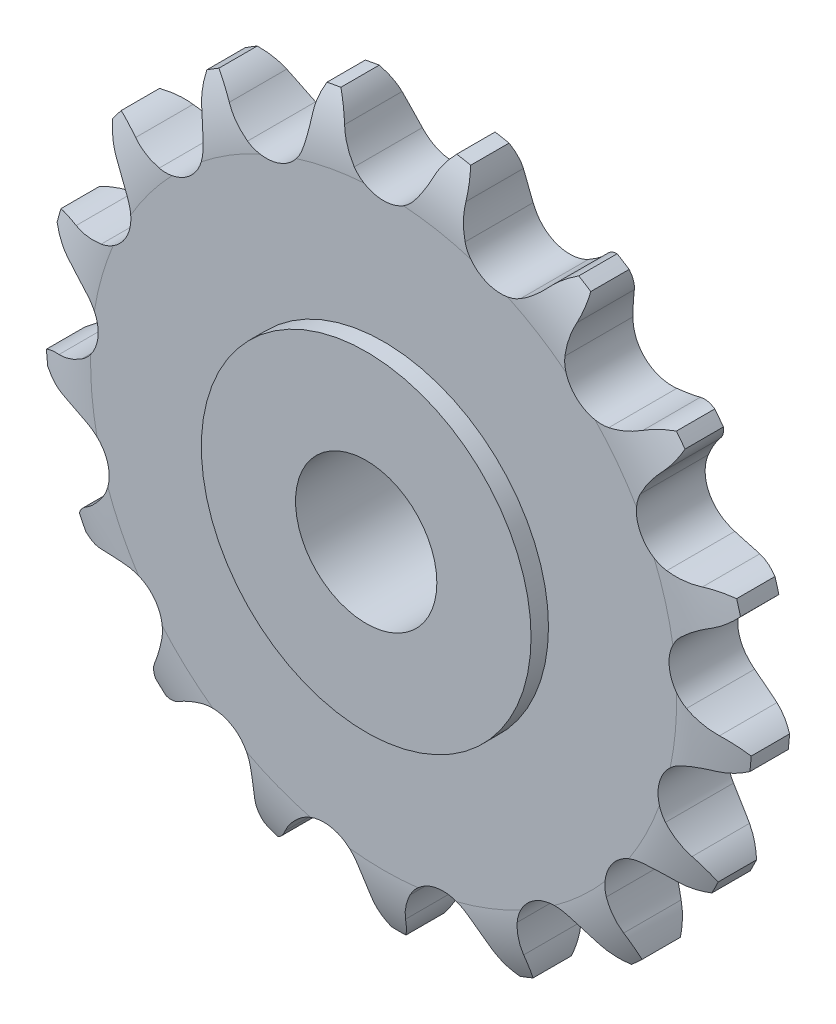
SolidWorks part; units mm, degrees
ref_plane "Front" through (0, 0, 0) normal (0, 0, 1) x (1, 0, 0)
ref_plane "Top" through (0, 0, 0) normal (0, 1, 0) x (1, 0, 0)
ref_plane "Right" through (0, 0, 0) normal (1, 0, 0) x (0, 0, -1)
sketch "ｽｹｯﾁ1" plane through (0, 0, 0) normal (1, 0, 0) x (0, 0, -1)
  line L0 (0, -42.5) -> (0, 0) construction
  line L1 (5.5, 17.5) -> (5.5, 7.5)
  line L3 (-5.5, 7.5) -> (-5.5, 17.5)
  line L4 (-3.65, 31.1) -> (-3.65, 17.5)
  line L8 (3.65, 17.5) -> (3.65, 31.1)
  line L10 (-10.5, 0) -> (10.5, 0) construction
  line L12 (-5.5, 7.5) -> (5.5, 7.5)
  line L14 (-5.5, 17.5) -> (-3.65, 17.5)
  line L15 (3.65, 17.5) -> (5.5, 17.5)
  line L17 (2.0365, 37.5) -> (-2.0365, 37.5)
  arc A4 (-2.0365, 37.5) -> (-3.65, 31.1) centre (9.85, 31.1) ccw
  arc A5 (3.65, 31.1) -> (2.0365, 37.5) centre (-9.85, 31.1) ccw
revolve "回転1" add sketch "ｽｹｯﾁ1" angle 360 about L10
sketch "ｽｹｯﾁ2" plane through (0, 0, 0) normal (0, 0, 1) x (1, 0, 0)
  arc A2 (-29.877, -11.7768) -> (-31.6016, -5.7154) centre (-33.1526, -9.4327) ccw
  arc A3 (31.6016, -5.7154) -> (29.877, -11.7768) centre (33.1526, -9.4327) ccw
  arc A4 (19.5034, -25.5136) -> (14.1454, -28.8311) centre (18.1453, -29.3056) ccw
  arc A5 (-12.8403, -35.2332) -> (-11.0486, -33.2967) centre (-16.6989, -29.8659) ccw
  arc A6 (-8.9698, -30.8362) -> (-11.0486, -33.2967) centre (-2.1761, -38.684) ccw
  arc A7 (-14.2669, -32.05) -> (-14.1454, -28.8312) centre (-24.4531, -30.0539) ccw
  arc A8 (-14.2669, -32.05) -> (-14.2474, -34.6881) centre (-7.7799, -33.3211) ccw
  arc A9 (-24.7009, -28.2155) -> (-14.2474, -34.6881) centre (0, 0) ccw
  arc A10 (-23.6052, -21.7743) -> (-27.403, -16.7453) centre (-27.5064, -20.7719) ccw
  arc A11 (-32.1353, -14.0737) -> (-33.8981, -16.0364) centre (-28.1977, -19.3833) ccw
  arc A12 (-37.2629, -4.2107) -> (-33.8981, -16.0364) centre (0, 0) ccw
  arc A13 (-27.403, -16.7453) -> (-30.5969, -17.1632) centre (-27.6694, -27.1218) ccw
  arc A14 (-33.2255, -17.3872) -> (-30.5969, -17.1632) centre (-32.4612, -10.8212) ccw
  arc A15 (-32.1353, -14.0737) -> (-29.877, -11.7768) centre (-38.3182, -5.7361) ccw
  arc A16 (-14.1454, -28.8312) -> (-19.5034, -25.5136) centre (-18.1453, -29.3056) ccw
  arc A17 (-24.8813, -24.7319) -> (-25.8161, -27.1989) centre (-19.2915, -28.2606) ccw
  arc A18 (-24.7009, -28.2155) -> (-22.3306, -27.0571) centre (-26.3601, -21.8168) ccw
  arc A19 (-19.5034, -25.5136) -> (-22.3306, -27.0571) centre (-16.0034, -35.2857) ccw
  arc A20 (-33.2255, -17.3872) -> (-25.8161, -27.1989) centre (0, 0) ccw
  arc A21 (-24.8813, -24.7319) -> (-23.6052, -21.7743) centre (-33.6585, -19.1909) ccw
  arc A22 (14.1454, -28.8311) -> (14.2669, -32.05) centre (24.4531, -30.0539) ccw
  arc A23 (-2.7752, -31.9942) -> (-8.9698, -30.8362) centre (-6.3336, -33.8815) ccw
  arc A24 (8.9698, -30.8362) -> (2.7752, -31.9942) centre (6.3336, -33.8815) ccw
  arc A25 (-1.7257, -35.0395) -> (-0.7545, -37.4924) centre (4.7824, -33.8815) ccw
  arc A26 (0.7545, -37.4924) -> (1.7257, -35.0395) centre (-4.7824, -33.8815) ccw
  arc A27 (-12.8403, -35.2332) -> (-0.7545, -37.4924) centre (0, 0) ccw
  arc A28 (-1.7257, -35.0395) -> (-2.7752, -31.9942) centre (-11.9451, -36.8579) ccw
  arc A29 (2.7752, -31.9942) -> (1.7257, -35.0395) centre (11.9451, -36.8579) ccw
  arc A30 (11.0486, -33.2967) -> (12.8403, -35.2332) centre (16.6989, -29.8659) ccw
  arc A31 (11.0486, -33.2967) -> (8.9698, -30.8362) centre (2.1761, -38.684) ccw
  arc A32 (0.7545, -37.4924) -> (12.8403, -35.2332) centre (0, 0) ccw
  arc A33 (14.2474, -34.6881) -> (14.2669, -32.05) centre (7.7799, -33.3211) ccw
  arc A34 (27.403, -16.7453) -> (23.6052, -21.7743) centre (27.5064, -20.7719) ccw
  arc A35 (25.8161, -27.1989) -> (24.8813, -24.7319) centre (19.2915, -28.2606) ccw
  arc A36 (22.3306, -27.0571) -> (24.7009, -28.2155) centre (26.3601, -21.8168) ccw
  arc A37 (22.3306, -27.0571) -> (19.5034, -25.5136) centre (16.0034, -35.2857) ccw
  arc A38 (14.2474, -34.6881) -> (24.7009, -28.2155) centre (0, 0) ccw
  arc A39 (23.6052, -21.7743) -> (24.8813, -24.7319) centre (33.6585, -19.1909) ccw
  arc A40 (33.8981, -16.0364) -> (32.1353, -14.0737) centre (28.1977, -19.3833) ccw
  arc A41 (30.5969, -17.1632) -> (27.403, -16.7453) centre (27.6694, -27.1218) ccw
  arc A42 (25.8161, -27.1989) -> (33.2255, -17.3872) centre (0, 0) ccw
  arc A43 (30.5969, -17.1632) -> (33.2255, -17.3872) centre (32.4612, -10.8212) ccw
  arc A44 (29.877, -11.7768) -> (32.1353, -14.0737) centre (38.3182, -5.7361) ccw
  arc A45 (19.0957, 32.2739) -> (16.9787, 30.6996) centre (21.9024, 26.289) ccw
  arc A46 (19.2023, 25.741) -> (23.8595, 21.4954) centre (23.2212, 25.4725) ccw
  arc A47 (-8.6069, 30.9395) -> (-8.1348, 34.1258) centre (-18.5143, 34.0354) ccw
  arc A48 (8.1348, 34.1258) -> (8.6069, 30.9395) centre (18.5143, 34.0354) ccw
  arc A49 (3.151, 31.9593) -> (4.7422, 34.76) centre (-4.9691, 38.4252) ccw
  arc A50 (-4.7422, 34.76) -> (-3.151, 31.9593) centre (4.9691, 38.4252) ccw
  arc A51 (-14.4832, 28.6629) -> (-8.6069, 30.9395) centre (-12.4514, 32.1408) ccw
  arc A52 (-30.0133, 11.4249) -> (-27.2043, 17.0661) centre (-30.8548, 15.3639) ccw
  arc A53 (-32.1137, -0.1887) -> (-31.5323, 6.0864) centre (-34.3214, 3.1803) ccw
  arc A54 (-35.0492, -1.5147) -> (-32.1137, -0.1887) centre (-37.8028, 8.4933) ccw
  arc A55 (-31.6016, -5.7154) -> (-34.7308, -4.9514) centre (-35.5985, -15.295) ccw
  arc A56 (-36.2676, 9.5346) -> (-37.4021, -2.7081) centre (0, 0) ccw
  arc A57 (-37.2629, -4.2107) -> (-34.7308, -4.9514) centre (-34.1782, 1.6358) ccw
  arc A58 (-35.0492, -1.5147) -> (-37.4021, -2.7081) centre (-33.2957, -7.8882) ccw
  arc A59 (-33.2296, 11.2488) -> (-35.8547, 10.986) centre (-33.8968, 4.6722) ccw
  arc A60 (-31.5323, 6.0864) -> (-34.1741, 7.9292) centre (-38.7198, -1.4025) ccw
  arc A61 (-30.3743, 21.9921) -> (-35.8547, 10.986) centre (0, 0) ccw
  arc A62 (-36.2676, 9.5346) -> (-34.1741, 7.9292) centre (-31.2793, 13.872) ccw
  arc A63 (-33.2296, 11.2488) -> (-30.0133, 11.4249) centre (-32.1819, 21.5757) ccw
  arc A64 (-26.9221, 22.4931) -> (-23.8595, 21.4954) centre (-22.2147, 31.7442) ccw
  arc A65 (-26.9221, 22.4931) -> (-29.4649, 23.1963) centre (-29.92, 16.6017) ccw
  arc A66 (-20.3787, 31.4795) -> (-29.4649, 23.1963) centre (0, 0) ccw
  arc A67 (-27.2043, 17.0661) -> (-29.0021, 19.7389) centre (-36.6117, 12.6794) ccw
  arc A68 (-30.3743, 21.9921) -> (-29.0021, 19.7389) centre (-24.1559, 24.2346) ccw
  arc A69 (-23.8595, 21.4954) -> (-19.2023, 25.741) centre (-23.2212, 25.4725) ccw
  arc A70 (-16.9787, 30.6996) -> (-19.0957, 32.2739) centre (-21.9024, 26.289) ccw
  arc A71 (-19.2023, 25.741) -> (-19.9131, 28.8827) centre (-29.5591, 25.0489) ccw
  arc A72 (-7.6309, 36.7154) -> (-19.0957, 32.2739) centre (0, 0) ccw
  arc A73 (-20.3787, 31.4795) -> (-19.9131, 28.8827) centre (-13.7702, 31.3242) ccw
  arc A74 (-16.9787, 30.6996) -> (-14.4832, 28.6629) centre (-9.2472, 37.6255) ccw
  arc A76 (-3.151, 31.9593) -> (3.151, 31.9593) centre (0, 34.4684) ccw
  arc A77 (8.6069, 30.9395) -> (14.4832, 28.6629) centre (12.4514, 32.1408) ccw
  arc A78 (14.4832, 28.6629) -> (16.9787, 30.6996) centre (9.2472, 37.6255) ccw
  arc A79 (6.1475, 36.9927) -> (-6.1475, 36.9927) centre (0, 0) ccw
  arc A80 (-7.6309, 36.7154) -> (-8.1348, 34.1258) centre (-1.5247, 34.1833) ccw
  arc A81 (-4.7422, 34.76) -> (-6.1475, 36.9927) centre (-10.9267, 32.4258) ccw
  arc A82 (8.1348, 34.1258) -> (7.6309, 36.7154) centre (1.5247, 34.1833) ccw
  arc A83 (19.0957, 32.2739) -> (7.6309, 36.7154) centre (0, 0) ccw
  arc A84 (6.1475, 36.9927) -> (4.7422, 34.76) centre (10.9267, 32.4258) ccw
  arc A85 (27.2043, 17.0661) -> (30.0133, 11.4249) centre (30.8548, 15.3639) ccw
  arc A86 (34.1741, 7.9292) -> (31.5323, 6.0864) centre (38.7198, -1.4025) ccw
  arc A87 (35.8547, 10.986) -> (33.2296, 11.2488) centre (33.8968, 4.6722) ccw
  arc A88 (34.7308, -4.9514) -> (31.6016, -5.7154) centre (35.5985, -15.295) ccw
  arc A89 (32.1137, -0.1887) -> (35.0492, -1.5147) centre (37.8028, 8.4933) ccw
  arc A90 (31.5323, 6.0864) -> (32.1137, -0.1887) centre (34.3214, 3.1803) ccw
  arc A91 (30.0133, 11.4249) -> (33.2296, 11.2488) centre (32.1819, 21.5757) ccw
  arc A92 (33.8981, -16.0364) -> (37.2629, -4.2107) centre (0, 0) ccw
  arc A93 (34.7308, -4.9514) -> (37.2629, -4.2107) centre (34.1782, 1.6358) ccw
  arc A94 (37.4021, -2.7081) -> (35.0492, -1.5147) centre (33.2957, -7.8882) ccw
  arc A95 (37.4021, -2.7081) -> (36.2676, 9.5346) centre (0, 0) ccw
  arc A96 (34.1741, 7.9292) -> (36.2676, 9.5346) centre (31.2793, 13.872) ccw
  arc A97 (35.8547, 10.986) -> (30.3743, 21.9921) centre (0, 0) ccw
  arc A98 (29.4649, 23.1963) -> (26.9221, 22.4931) centre (29.92, 16.6017) ccw
  arc A99 (23.8595, 21.4954) -> (26.9221, 22.4931) centre (22.2147, 31.7442) ccw
  arc A100 (29.0021, 19.7389) -> (27.2043, 17.0661) centre (36.6117, 12.6794) ccw
  arc A101 (29.0021, 19.7389) -> (30.3743, 21.9921) centre (24.1559, 24.2346) ccw
  arc A102 (19.9131, 28.8827) -> (19.2023, 25.741) centre (29.5591, 25.0489) ccw
  arc A103 (19.9131, 28.8827) -> (20.3787, 31.4795) centre (13.7702, 31.3242) ccw
  arc A104 (29.4649, 23.1963) -> (20.3787, 31.4795) centre (0, 0) ccw
extrude "ｶｯﾄ - 押し出し1" cut sketch "ｽｹｯﾁ2" against normal through all both and the other way through all
